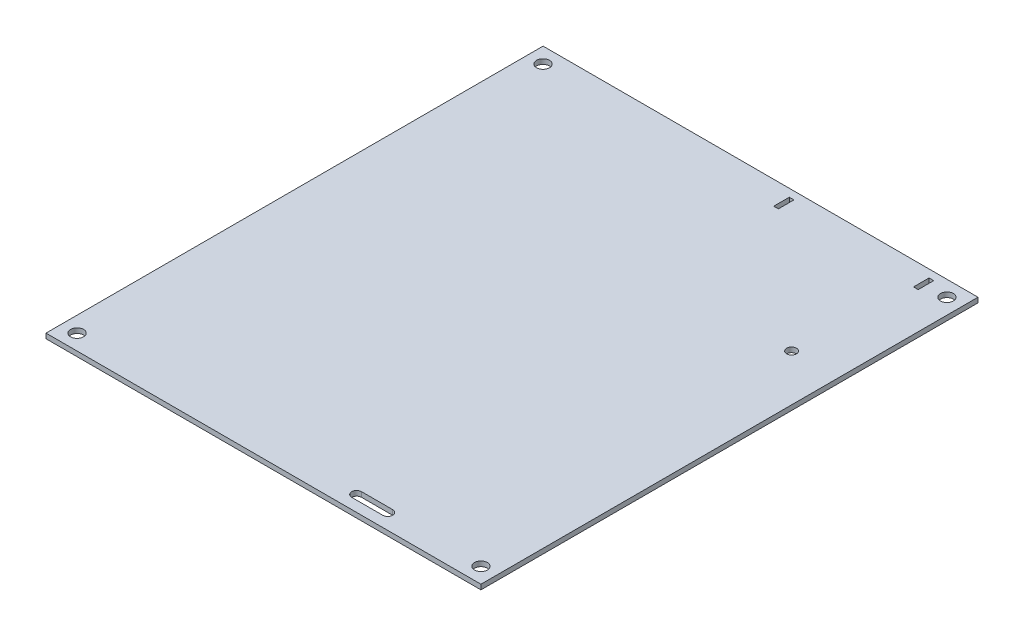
SolidWorks part; units mm, degrees
ref_plane "Front Plane" through (0, 0, 0) normal (0, 0, 1) x (1, 0, 0)
ref_plane "Top Plane" through (0, 0, 0) normal (0, 1, 0) x (1, 0, 0)
ref_plane "Right Plane" through (0, 0, 0) normal (1, 0, 0) x (0, 0, -1)
sketch "Sketch1" plane through (0, 0, 0) normal (0, 1, 0) x (1, 0, 0)
  line L0 (190, 10) -> (210, 10) construction
  line L1 (0, 0) -> (140, 0)
  line L2 (0, 0) -> (0, 160)
  line L3 (0, 320) -> (280, 320)
  line L4 (280, 0) -> (280, 320)
  line L5 (140, 320) -> (140, 0) construction
  line L6 (0, 160) -> (280, 160) construction
  line L7 (190, 13.175) -> (210, 13.175)
  line L8 (190, 6.825) -> (210, 6.825)
  line L9 (0, 160) -> (140, 160) construction
  line L10 (140, 160) -> (140, 0) construction
  line L11 (140, 0) -> (280, 0)
  line L12 (0, 160) -> (0, 320)
  line L15 (90, 230) -> (250, 230) construction
  line L17 (65, 295) -> (280, 295) construction
  line L18 (65, 295) -> (65, 292.0028) construction
  line L19 (65, 292.0028) -> (280, 292.0028) construction
  line L20 (280, 295) -> (280, 292.0028) construction
  line L21 (172.5, 292.0028) -> (172.5, 295) construction
  line L22 (65, 293.5014) -> (280, 293.5014) construction
  line L23 (245.75, 218) -> (254.25, 218) construction
  line L24 (245.75, 218) -> (245.75, 242) construction
  line L25 (245.75, 242) -> (254.25, 242) construction
  line L26 (254.25, 218) -> (254.25, 242) construction
  line L27 (250, 242) -> (250, 218) construction
  line L28 (245.75, 230) -> (254.25, 230) construction
  line L29 (163.5014, 315) -> (166.4986, 315)
  line L30 (163.5014, 315) -> (163.5014, 305)
  line L31 (163.5014, 305) -> (166.4986, 305)
  line L32 (166.4986, 315) -> (166.4986, 305)
  line L33 (165, 305) -> (165, 315) construction
  line L34 (163.5014, 310) -> (166.4986, 310) construction
  line L35 (253.5014, 315) -> (256.4986, 315)
  line L36 (253.5014, 315) -> (253.5014, 305)
  line L37 (253.5014, 305) -> (256.4986, 305)
  line L38 (256.4986, 315) -> (256.4986, 305)
  line L39 (255, 305) -> (255, 315) construction
  line L40 (253.5014, 310) -> (256.4986, 310) construction
  circle A0 centre (250, 230) radius 3.175
  circle A1 centre (200, 10) radius 3.175 construction
  arc A2 (190, 13.175) -> (190, 6.825) centre (190, 10) ccw
  arc A3 (210, 6.825) -> (210, 13.175) centre (210, 10) ccw
  circle A6 centre (10, 310) radius 4.175
  circle A7 centre (10, 10) radius 4.175
  circle A8 centre (270, 10) radius 4.175
  circle A9 centre (270, 310) radius 4.175
  point P8 (200, 10)
  point P49 (84.3053, 266.8183)
  point P50 (83.9621, 191.5087)
  point P51 (0, 0)
  point P52 (0, 0)
  point P308 (172.5, 293.5014)
  point P347 (165, 310)
  point P360 (140, 160)
  point P368 (255, 310)
  dimension "D1" = 6.35
  dimension "D2" = 6.35
  dimension "D5" = 6.35
  dimension "D12" = 160
  dimension "D13" = 215
  dimension "D27" = 8.35
  dimension "D36" = 8.35
  dimension "D3" = 220
  dimension "D4" = 50
  dimension "D6" = 20
  dimension "D7" = 30
  dimension "D8" = 90
  dimension "D9" = 320
  dimension "D10" = 280
  dimension "D11" = 8.5
  dimension "D14" = 25
  dimension "D15" = 90
  dimension "D16" = 24
  dimension "D17" = 2.9972
  dimension "D18" = 10
  dimension "D19" = 2.9972
  dimension "D20" = 10
  dimension "D21" = 2.9972
  dimension "D22" = 15
  dimension "D23" = 15
  dimension "D26" = 10
  dimension "D28" = 10
  dimension "D29" = 10
  dimension "D31" = 10
  dimension "D32" = 10
  dimension "D34" = 10
  dimension "D35" = 10
  dimension "D37" = 10
  dimension "D38" = 10
extrude "Boss-Extrude1" add sketch "Sketch1" along normal blind 3.175
